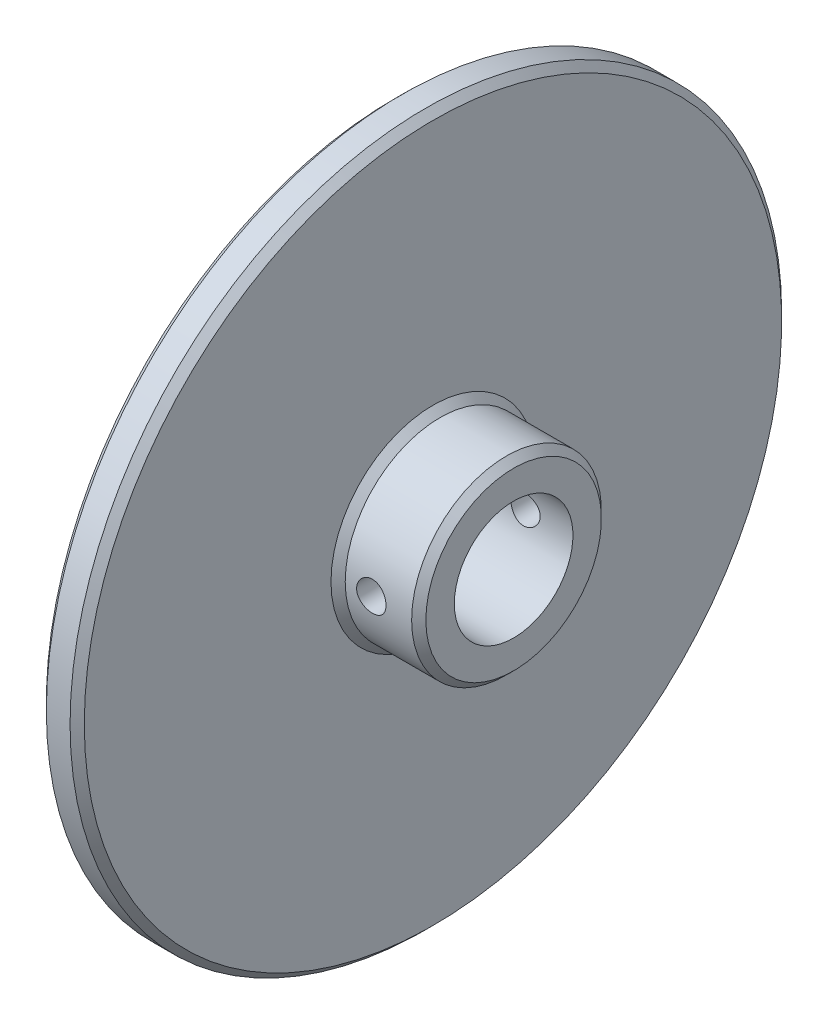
SolidWorks part; units mm, degrees
ref_plane "Plan de face" through (0, 0, 0) normal (0, 0, 1) x (1, 0, 0)
ref_plane "Plan de dessus" through (0, 0, 0) normal (0, 1, 0) x (1, 0, 0)
ref_plane "Plan de droite" through (0, 0, 0) normal (1, 0, 0) x (0, 0, -1)
sketch "Esquisse1" plane through (0, 0, 0) normal (0, 0, 1) x (1, 0, 0)
  line L0 (-43.7053, 0) -> (76.2392, 0) construction
  line L2 (0, 75) -> (8, 75)
  line L3 (0, 75) -> (0, 12.5)
  line L5 (8, 75) -> (8, 20)
  line L6 (0, 12.5) -> (25, 12.5)
  line L8 (8, 20) -> (25, 20)
  line L9 (25, 12.5) -> (25, 20)
  dimension "D1" = 25
  dimension "D2" = 8
  dimension "D3" = 12.5
  dimension "D4" = 20
  dimension "D5" = 75
revolve "Révolution1" add sketch "Esquisse1" angle 360 about L0
chamfer "Chanfrein1" distance 1.5 angle 45 5 edges at (0, 0, 12.5) (25, 0, 20) (8, 0, 75) (0, 0, 75) (8, 0, 20)
sketch "Esquisse2" plane through (0, 0, 0) normal (0, 0, 1) x (1, 0, 0)
  circle A0 centre (15, 0) radius 3.1
  dimension "D1" = 6.2
  dimension "D2" = 15
extrude "Enlèv. mat.-Extru.1" cut sketch "Esquisse2" against normal through all and the other way through all
